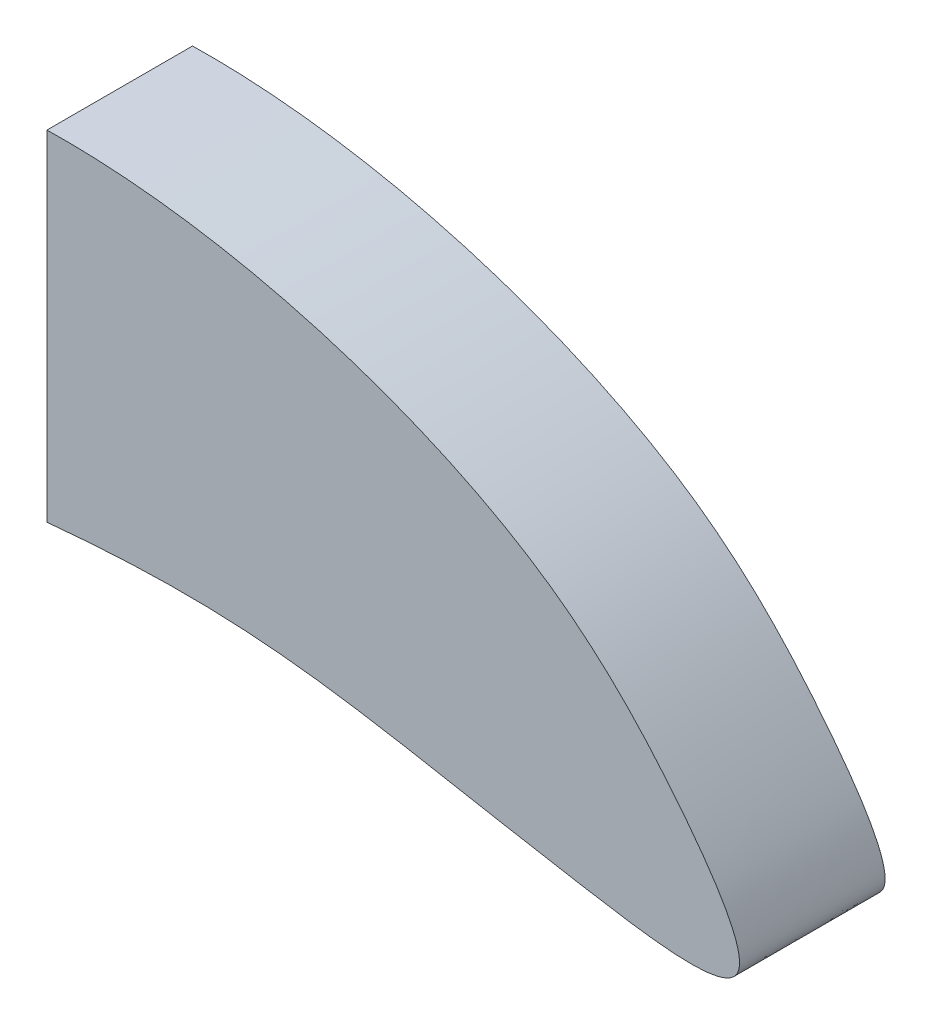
SolidWorks part; units mm, degrees
ref_plane "Alzado" through (0, 0, 0) normal (0, 0, 1) x (1, 0, 0)
ref_plane "Planta" through (0, 0, 0) normal (0, 1, 0) x (1, 0, 0)
ref_plane "Vista lateral" through (0, 0, 0) normal (1, 0, 0) x (0, 0, -1)
sketch "Croquis1" plane through (0, 0, 0) normal (0, 0, 1) x (1, 0, 0)
  line L0 (0, 0) -> (0, 14)
  spline S0 degree 3 poles (0, 14) (6.3416, 14.1314) (17.1942, 11.3977) (24.8297, 4.9854) (30.4927, -3.2466) (13.9301, -0.801) (9.5745, 0.9101) (0, 0) knots 0 0 0 0 0.31038 0.46466 0.546692 0.637851 1 1 1 1
  point P4 (10.622, 0)
  dimension "D1" = 14
extrude "Saliente-Extruir1" add sketch "Croquis1" along normal blind 6
